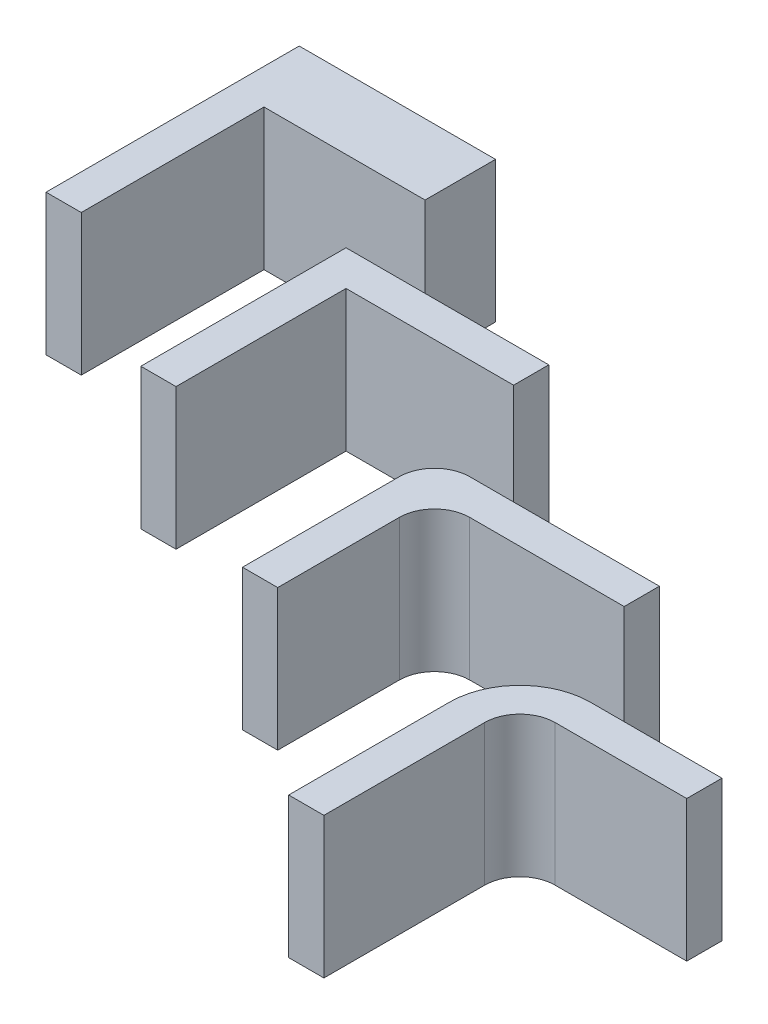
SolidWorks part; units mm, degrees
ref_plane "Front" through (0, 0, 0) normal (0, 0, 1) x (1, 0, 0)
ref_plane "Top" through (0, 0, 0) normal (0, 1, 0) x (1, 0, 0)
ref_plane "Right" through (0, 0, 0) normal (1, 0, 0) x (0, 0, -1)
sketch "Sketch1" plane through (0, 0, 0) normal (0, 1, 0) x (1, 0, 0)
  line L0 (0, 0) -> (0, 35.9423)
  line L1 (0, 35.9423) -> (27.8672, 35.9423)
  line L2 (0, 0) -> (5, 0)
  line L3 (5, 0) -> (5, 25.9423)
  line L4 (5, 25.9423) -> (27.8672, 25.9423)
  line L5 (27.8672, 25.9423) -> (27.8672, 35.9423)
  line L7 (28.1289, -14.6731) -> (28.1289, 14.4596)
  line L8 (28.1289, 14.4596) -> (56.9146, 14.4596)
  line L9 (56.9146, 14.4596) -> (56.9146, 9.4596)
  line L10 (56.9146, 9.4596) -> (33.1289, 9.4596)
  line L11 (33.1289, 9.4596) -> (33.1289, -14.6731)
  line L12 (33.1289, -14.6731) -> (28.1289, -14.6731)
  line L13 (91.9807, -4.9053) -> (60.0548, -4.9053)
  line L14 (60.0548, -4.9053) -> (60.0548, -32.1637)
  line L15 (60.0548, -32.1637) -> (65.0548, -32.1637)
  line L16 (65.0548, -32.1637) -> (65.0548, -9.9053)
  line L17 (65.0548, -9.9053) -> (91.9807, -9.9053)
  line L18 (91.9807, -9.9053) -> (91.9807, -4.9053)
  dimension "D1" = 5
  dimension "D2" = 10
  dimension "D3" = 5
  dimension "D4" = 5
  dimension "D5" = 5
  dimension "D6" = 5
extrude "Boss-Extrude1" add sketch "Sketch1" along normal blind 20
fillet "Fillet1" radius 5 2 edges at (60.0548, 10, 4.9053) (65.0548, 10, 9.9053)
sketch "Sketch2" plane through (0, 0, 0) normal (0, 1, 0) x (1, 0, 0)
  line L0 (120.0238, -24.0672) -> (101.3364, -24.0672)
  line L1 (91.3364, -34.0672) -> (91.3364, -56.8897)
  line L2 (120.0238, -29.0672) -> (101.3364, -29.0672)
  line L3 (96.3364, -34.0672) -> (96.3364, -56.8897)
  line L4 (120.0238, -24.0672) -> (120.0238, -29.0672)
  line L5 (96.3364, -56.8897) -> (91.3364, -56.8897)
  arc A0 (101.3364, -24.0672) -> (91.3364, -34.0672) centre (101.3364, -34.0672) ccw
  arc A1 (101.3364, -29.0672) -> (96.3364, -34.0672) centre (101.3364, -34.0672) ccw
  dimension "D1" = 10
  dimension "D2" = 5
extrude "Boss-Extrude2" add sketch "Sketch2" along normal blind 20 separate body
